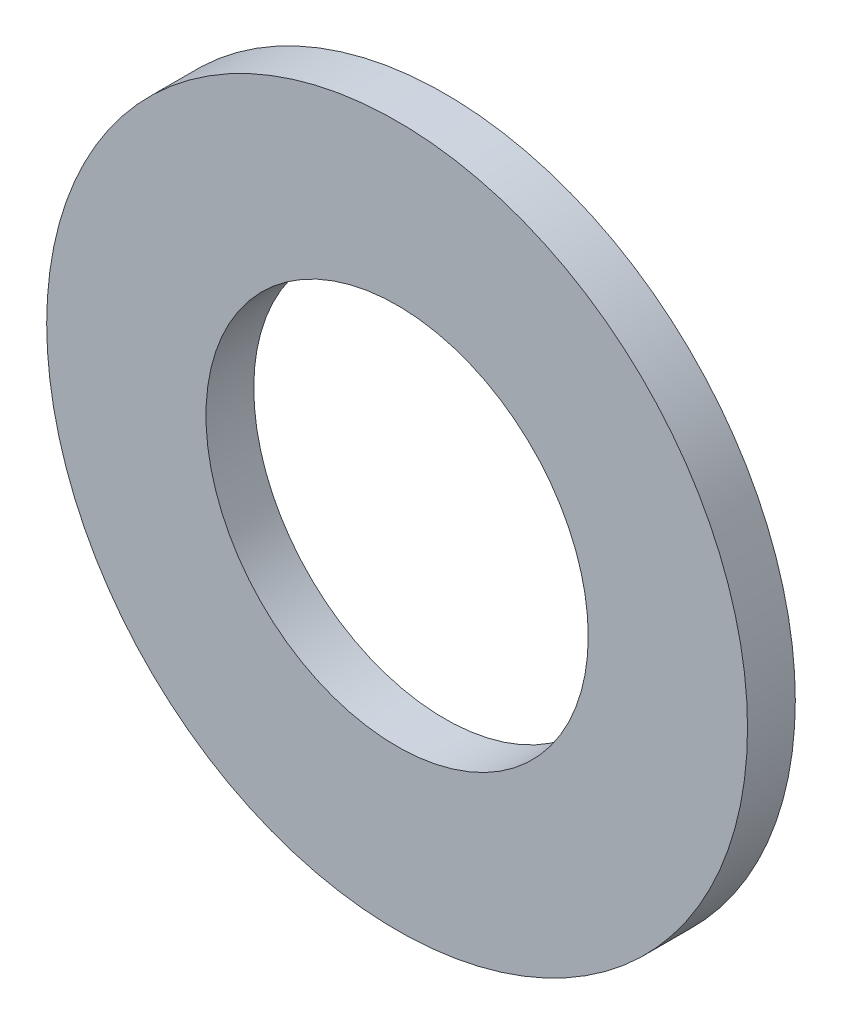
SolidWorks part; units mm, degrees
ref_plane "Plan de face" through (0, 0, 0) normal (0, 0, 1) x (1, 0, 0)
ref_plane "Plan de dessus" through (0, 0, 0) normal (0, 1, 0) x (1, 0, 0)
ref_plane "Plan de droite" through (0, 0, 0) normal (1, 0, 0) x (0, 0, -1)
sketch "Esquisse1" plane through (0, 0, 0) normal (0, 0, 1) x (1, 0, 0)
  circle A0 centre (-2, 380) radius 6
  circle A1 centre (-2, 380) radius 11
  circle A4 centre (-2, 380) radius 6 construction
  dimension "D1" = 22
extrude "Extrusion1" add sketch "Esquisse1" against normal up to surface (1.5 mm away)
